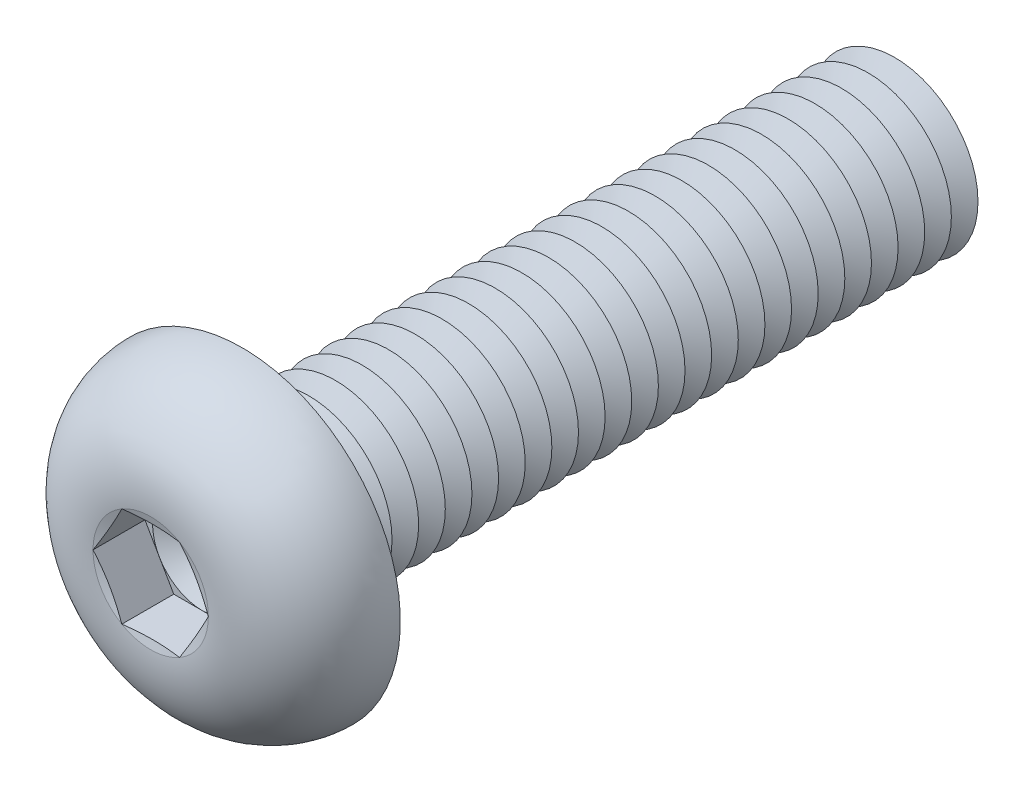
SolidWorks part; units mm, degrees
ref_plane "Front Plane" through (0, 0, 0) normal (0, 0, 1) x (1, 0, 0)
ref_plane "Top Plane" through (0, 0, 0) normal (0, 1, 0) x (1, 0, 0)
ref_plane "Right Plane" through (0, 0, 0) normal (1, 0, 0) x (0, 0, -1)
sketch "Sketch1" plane through (0, 0, 0) normal (1, 0, 0) x (0, 0, -1)
  line L0 (0, 2.5) -> (0, 4.75)
  line L3 (0, 2.5) -> (20, 2.5)
  line L4 (20, 2.5) -> (20, 0)
  line L5 (20, 0) -> (-2.75, 0) construction
  line L6 (-2.75, 0) -> (20, 0)
  line L7 (-2.75, 1.732) -> (-2.75, 0.866) construction
  line L8 (-2.75, 0.866) -> (-2.75, 0)
  line L9 (-2.75, 1.732) -> (-2.5179, 0.866)
  line L10 (-2.5179, 0.866) -> (-2.75, 0.866)
  line L11 (20, 0) -> (22.7481, 0) construction
  line L12 (0, 4.75) -> (-2.75, 4.75) construction
  arc A1 (0, 4.75) -> (-2.75, 1.732) centre (0, 1.9881) ccw
  point P8 (20, 1.25)
  dimension "D1" = 9.5
  dimension "D2" = 5
  dimension "D3" = 2.75
  dimension "D4" = 3.4641
  dimension "D5" = 20
  dimension "D6" = 15
revolve "Revolve1" add sketch "Sketch1" angle 360 about L5
fillet "Fillet1" radius 0.4 1 edges at (-2.5, 0, 0)
sketch "Sketch2" plane through (0, 0, 0) normal (1, 0, 0) x (0, 0, -1)
  line L0 (19.6, 2.5) -> (20.4, 2.5)
  line L1 (20, 2.5) -> (0.4, 2.5) construction
  line L2 (20.4, 2.5) -> (20, 1.8072)
  line L3 (20, -2.5) -> (20, 2.5) construction
  line L4 (20, 1.8072) -> (19.6, 2.5)
  dimension "D1" = 0.8
revolve "Cut-Revolve1" cut sketch "Sketch2" angle 360 about axis through (0, 0, -20) along (0, 0, -1)
pattern_linear "LPattern1" count 25 spacing 0.8 along (0, 0, 1) of "Cut-Revolve1"
sketch "Sketch3" plane through (0, 0, 2.75) normal (0, 0, 1) x (1, 0, 0)
  line L7 (0.866, 1.5) -> (-0.866, 1.5)
  line L8 (-0.866, 1.5) -> (-1.7321, 0)
  line L9 (-1.7321, 0) -> (-0.866, -1.5)
  line L10 (-0.866, -1.5) -> (0.866, -1.5)
  line L11 (0.866, -1.5) -> (1.7321, 0)
  line L12 (1.7321, 0) -> (0.866, 1.5)
  circle A0 centre (0, 0) radius 1.5 construction
  circle A3 centre (0, 0) radius 1.732 construction
extrude "Cut-Extrude1" cut sketch "Sketch3" against normal blind 1.56
sketch "Sketch4" plane through (0, 0, 1.19) normal (0, 0, 1) x (1, 0, 0)
  line L1 (0.866, 1.5) -> (-0.866, 1.5) construction
  circle A0 centre (0, 0) radius 1.5
extrude "Cut-Extrude2" cut sketch "Sketch4" against normal through all draft 60
